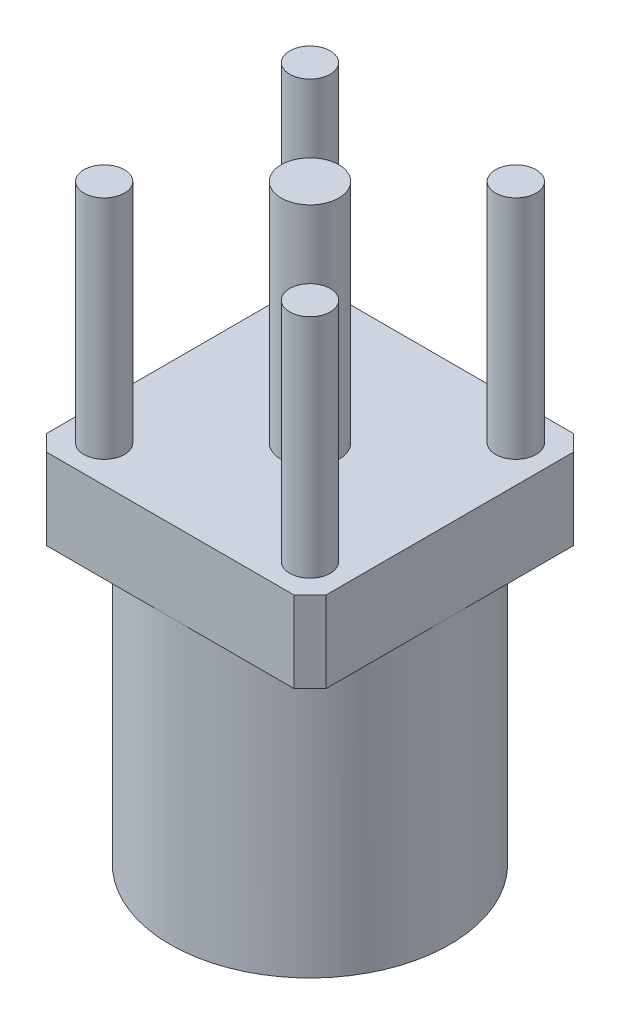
SolidWorks part; units mm, degrees
ref_plane "Front Plane" through (0, 0, 0) normal (0, 0, 1) x (1, 0, 0)
ref_plane "Top Plane" through (0, 0, 0) normal (0, 1, 0) x (1, 0, 0)
ref_plane "Right Plane" through (0, 0, 0) normal (1, 0, 0) x (0, 0, -1)
sketch "Sketch3" plane through (0, 0, 0) normal (0, 1, 0) x (1, 0, 0)
  line L0 (-1.725, -1.525) -> (-1.525, -1.725)
  line L1 (-1.525, -1.725) -> (1.525, -1.725)
  line L2 (-1.725, -1.525) -> (-1.725, 1.525)
  line L3 (-1.525, 1.725) -> (1.525, 1.725)
  line L4 (1.725, -1.525) -> (1.725, 1.525)
  line L5 (1.525, -1.725) -> (1.725, -1.525)
  line L6 (1.525, 1.725) -> (1.725, 1.525)
  line L7 (-1.725, 1.525) -> (-1.525, 1.725)
  line L9 (-1.27, -1.27) -> (1.27, -1.27) construction
  line L10 (-1.27, -1.27) -> (-1.27, 1.27) construction
  line L11 (-1.27, 1.27) -> (1.27, 1.27) construction
  line L12 (1.27, -1.27) -> (1.27, 1.27) construction
  circle A0 centre (0, 0) radius 1.725 construction
  circle A1 centre (0, 0) radius 1.375 construction
  circle A2 centre (0, 0) radius 0.35 construction
  circle A3 centre (-1.27, -1.27) radius 0.25 construction
  circle A4 centre (1.27, -1.27) radius 0.25 construction
  circle A5 centre (1.27, 1.27) radius 0.25 construction
  circle A6 centre (-1.27, 1.27) radius 0.25 construction
  point P0 (-1.725, -1.725)
  point P1 (1.725, 1.725)
  point P2 (-1.725, 1.725)
  point P3 (1.725, -1.725)
  point P23 (0, -1.27)
  point P24 (-1.27, 0)
  dimension "D3" = 0.7
  dimension "D4" = 0.5
  dimension "D1" = 3.45
  dimension "D5" = 2.54
  dimension "D2" = 0.35
extrude "Boss-Extrude1" add sketch "Sketch3" along normal blind 1
sketch "Sketch4" plane through (0, 0, 0) normal (0, -1, 0) x (1, 0, 0)
  line L8 (1.525, 1.725) -> (-1.525, 1.725)
  line L9 (-1.525, 1.725) -> (-1.725, 1.525)
  line L10 (-1.725, 1.525) -> (-1.725, -1.525)
  line L11 (-1.725, -1.525) -> (-1.525, -1.725)
  line L12 (-1.525, -1.725) -> (1.525, -1.725)
  line L13 (1.525, -1.725) -> (1.725, -1.525)
  line L14 (1.725, -1.525) -> (1.725, 1.525)
  line L15 (1.725, 1.525) -> (1.525, 1.725)
  line L16 (1.525, 1.725) -> (-1.525, 1.725)
  line L17 (-1.525, 1.725) -> (-1.725, 1.525)
  line L18 (-1.725, 1.525) -> (-1.725, -1.525)
  line L19 (-1.725, -1.525) -> (-1.525, -1.725)
  line L20 (-1.525, -1.725) -> (1.525, -1.725)
  line L21 (1.525, -1.725) -> (1.725, -1.525)
  line L22 (1.725, -1.525) -> (1.725, 1.525)
  line L23 (1.725, 1.525) -> (1.525, 1.725)
  circle A0 centre (0, 0) radius 1.725 construction
  circle A1 centre (0, 0) radius 1.375 construction
  circle A2 centre (0, 0) radius 0.35 construction
  circle A3 centre (0, 0) radius 1.725
  circle A4 centre (0, 0) radius 1.375
  circle A5 centre (0, 0) radius 0.35
  dimension "D1" = 0
extrude "Boss-Extrude2" add sketch "Sketch4" along normal blind 3.5 contours A3 A4 | A5
sketch "Sketch5" plane through (0, 1, 0) normal (0, 1, 0) x (1, 0, 0)
  circle A0 centre (-1.27, 1.27) radius 0.25 construction
  circle A1 centre (-1.27, -1.27) radius 0.25 construction
  circle A2 centre (1.27, 1.27) radius 0.25 construction
  circle A3 centre (1.27, -1.27) radius 0.25 construction
  circle A4 centre (-1.27, 1.27) radius 0.25
  circle A5 centre (-1.27, -1.27) radius 0.25
  circle A6 centre (1.27, 1.27) radius 0.25
  circle A7 centre (1.27, -1.27) radius 0.25
  circle A8 centre (0, 0) radius 0.3556
  dimension "D1" = 0.5
  dimension "D2" = 0.7112
extrude "Boss-Extrude3" add sketch "Sketch5" along normal blind 2.794
sketch "Sketch6" plane through (0, -3.5, 0) normal (0, -1, 0) x (1, 0, 0)
  circle A1 centre (0, 0) radius 0.35
  circle A2 centre (0, 0) radius 0.35
  dimension "D1" = 0
extrude "Cut-Extrude1" cut sketch "Sketch6" against normal blind 1.016
